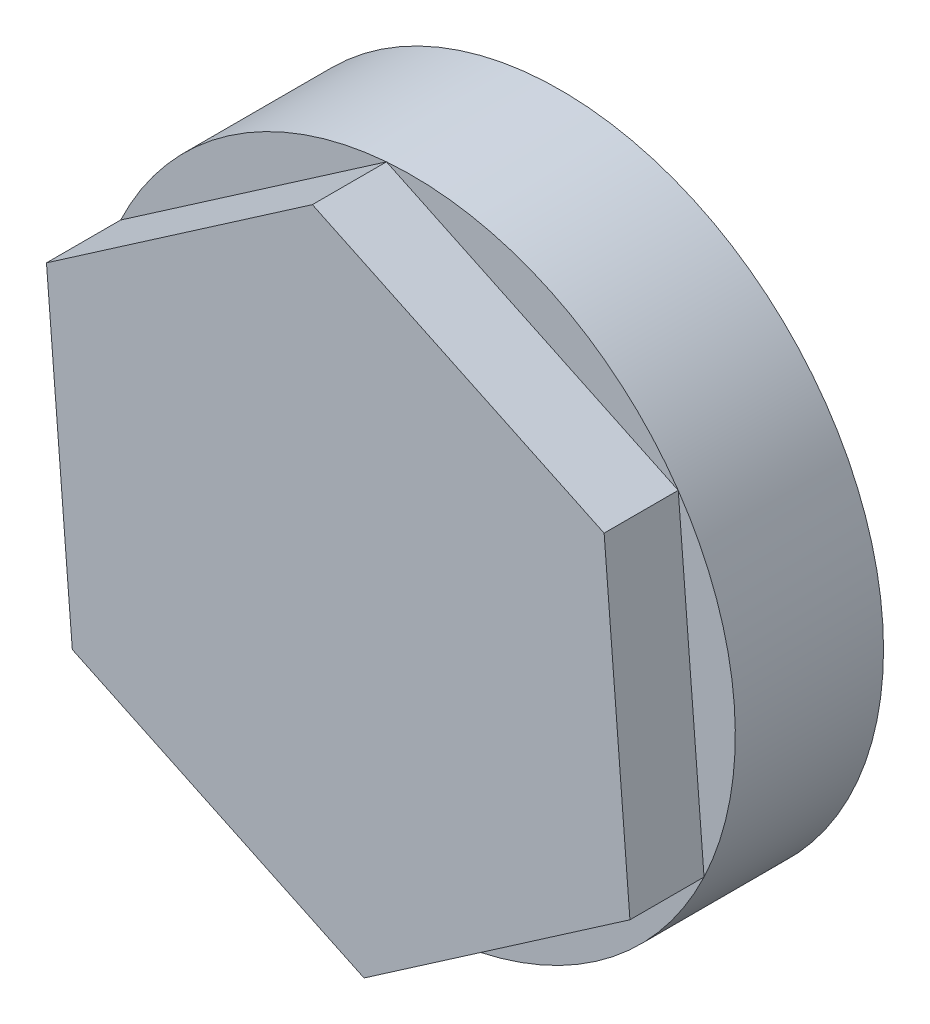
SolidWorks part; units mm, degrees
ref_plane "Ebene vorne" through (0, 0, 0) normal (0, 0, 1) x (1, 0, 0)
ref_plane "Ebene oben" through (0, 0, 0) normal (0, 1, 0) x (1, 0, 0)
ref_plane "Ebene rechts" through (0, 0, 0) normal (1, 0, 0) x (0, 0, -1)
sketch "Skizze1" plane through (0, 0, 0) normal (0, 0, 1) x (1, 0, 0)
  line L1 (0, 0) -> (116.5561, 0)
  line L2 (0, 0) -> (0, 99.1284)
  line L3 (0, 99.1284) -> (116.5561, 99.1284)
  line L4 (116.5561, 0) -> (116.5561, 99.1284)
extrude "Linear austragen1" add sketch "Skizze1" along normal blind 5
sketch "Skizze3" plane through (0, 0, 5) normal (0, 0, 1) x (1, 0, 0)
  circle A0 centre (39.8386, 59.6717) radius 21.792
extrude "Linear austragen3" add sketch "Skizze3" along normal blind 5
sketch "Skizze2" plane through (0, 0, 10) normal (0, 0, 1) x (1, 0, 0)
  line L1 (59.522, 50.3202) -> (57.779, 72.0423)
  line L2 (57.779, 72.0423) -> (38.0956, 81.3939)
  line L3 (38.0956, 81.3939) -> (20.1552, 69.0233)
  line L4 (20.1552, 69.0233) -> (21.8982, 47.3011)
  line L5 (21.8982, 47.3011) -> (41.5817, 37.9496)
  line L6 (41.5817, 37.9496) -> (59.522, 50.3202)
  circle A0 centre (39.8386, 59.6717) radius 18.8724 construction
  circle A1 centre (39.8386, 59.6717) radius 21.792 construction
extrude "Linear austragen2" add sketch "Skizze2" along normal blind 5
sketch "Skizze4" plane through (0, 0, 5) normal (0, 0, 1) x (1, 0, 0)
  circle A0 centre (39.8386, 59.6717) radius 21.792 construction
  circle A1 centre (39.8386, 59.6717) radius 21.792
extrude "Schnitt-Linear austragen1" cut sketch "Skizze4" against normal blind 5 flip side to cut
sketch "Skizze5" plane through (0, 0, 0) normal (0, 0, -1) x (-1, 0, 0)
  circle A1 centre (-39.8386, 59.6717) radius 21.792
  circle A2 centre (-39.8386, 59.6717) radius 21.792
  dimension "D1" = 0
equation "\"LÄNGE\"=0"
equation "\"BREITE\"=0"
equation "\"HÖHE\"=0"
equation "\"DURCHMESSER\"=0"
equation "\"Stückzahl\"= 1"
